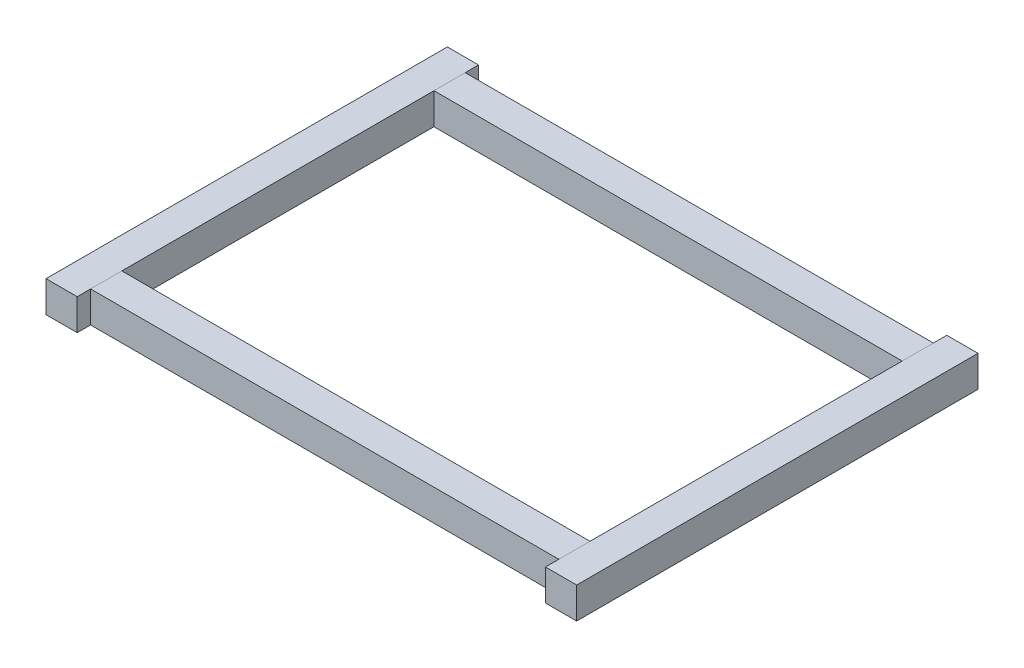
SolidWorks part; units mm, degrees
ref_plane "Plan de face" through (0, 0, 0) normal (0, 0, 1) x (1, 0, 0)
ref_plane "Plan de dessus" through (0, 0, 0) normal (0, 1, 0) x (1, 0, 0)
ref_plane "Plan de droite" through (0, 0, 0) normal (1, 0, 0) x (0, 0, -1)
sketch "Esquisse1" plane through (0, 0, 0) normal (0, 0, 1) x (1, 0, 0)
  line L0 (224, 14) -> (210, 14)
  line L1 (0, 0) -> (-14, 0)
  line L2 (0, 0) -> (0, 14)
  line L3 (0, 14) -> (-14, 14)
  line L4 (-14, 0) -> (-14, 14)
  line L5 (224, 0) -> (224, 14)
  line L6 (224, 0) -> (210, 0)
  line L7 (210, 0) -> (210, 14)
  dimension "D1" = 14
  dimension "D2" = 14
  dimension "D4" = 210
  dimension "D3" = 2
extrude "Boss.-Extru.1" add sketch "Esquisse1" along normal blind 180
sketch "Esquisse2" plane through (0, 0, 0) normal (1, 0, 0) x (0, 0, -1)
  line L0 (-180, 14) -> (0, 14) construction
  line L1 (-6, 14) -> (-20, 14)
  line L2 (-6, 14) -> (-6, 0)
  line L3 (-6, 0) -> (-20, 0)
  line L4 (-20, 14) -> (-20, 0)
  line L5 (-180, 0) -> (0, 0) construction
  line L6 (0, 0) -> (0, 14) construction
  line L7 (-174, 14) -> (-160, 14)
  line L8 (-174, 14) -> (-174, 0)
  line L9 (-174, 0) -> (-160, 0)
  line L10 (-160, 14) -> (-160, 0)
  dimension "D1" = 6
  dimension "D2" = 14
  dimension "D3" = 140
  dimension "D4" = 14
extrude "Boss.-Extru.2" add sketch "Esquisse2" along normal up to next separate body
